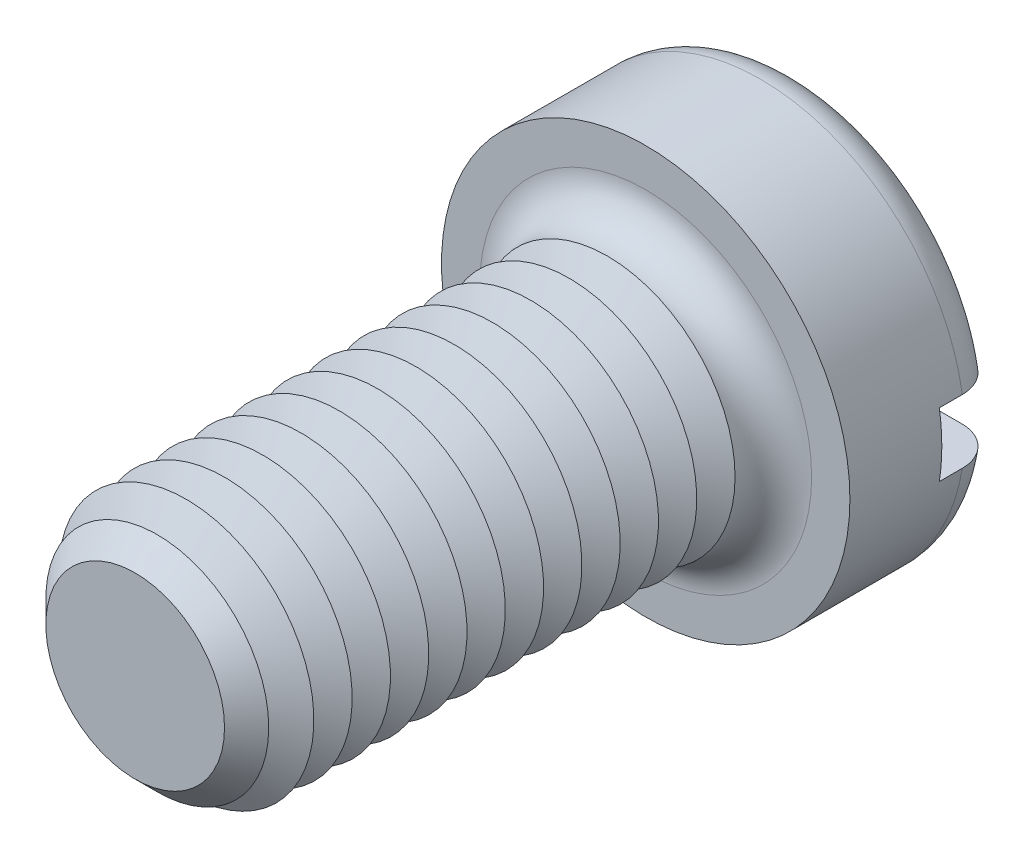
SolidWorks part; units mm, degrees
ref_plane "Front Plane" through (0, 0, 0) normal (0, 0, 1) x (1, 0, 0)
ref_plane "Top Plane" through (0, 0, 0) normal (0, 1, 0) x (1, 0, 0)
ref_plane "Right Plane" through (0, 0, 0) normal (1, 0, 0) x (0, 0, -1)
sketch "Sketch3" plane through (0, 0, 0) normal (0, 0, 1) x (1, 0, 0)
  circle A0 centre (0, 0) radius 8
  dimension "D1" = 16
extrude "Boss-Extrude2" add sketch "Sketch3" against normal blind 6
sketch "Sketch4" plane through (0, 0, 0) normal (0, 0, 1) x (1, 0, 0)
  circle A0 centre (0, 0) radius 5
  dimension "D1" = 10
extrude "Boss-Extrude3" add sketch "Sketch4" along normal blind 20
fillet "Fillet1" radius 1.5 2 edges at (8, 0, -6) (5, 0, 0)
chamfer "Chamfer1" distance 1.5 angle 45 1 edges at (5, 0, 20)
sketch "Sketch5" plane through (0, 0, 0) normal (1, 0, 0) x (0, 0, -1)
  line L0 (1.6944, 0) -> (-7.6738, 0) construction
sketch "Sketch6" plane through (0, 0, 0) normal (1, 0, 0) x (0, 0, -1)
  line L0 (-1.5, 5) -> (-2.25, 3.701)
  line L1 (-2.25, 3.701) -> (-3, 5)
  line L2 (-1.5, 5) -> (-18.5, 5) construction
  line L3 (-3, 5) -> (-1.5, 5)
  dimension "D1" = 1.5
revolve "Cut-Revolve1" cut sketch "Sketch6" angle 360 about L0
pattern_linear "LPattern1" count 12 spacing 1.5 along (0, 0, 1) of "Cut-Revolve1"
sketch "Sketch8" plane through (0, 0, -6) normal (0, 0, -1) x (-1, 0, 0)
  line L1 (8, -1.25) -> (-8, -1.25)
  line L2 (8, -1.25) -> (8, 1.25)
  line L3 (8, 1.25) -> (-8, 1.25)
  line L4 (-8, -1.25) -> (-8, 1.25)
  line L5 (8, -1.25) -> (-8, 1.25) construction
  line L6 (8, 1.25) -> (-8, -1.25) construction
  point P0 (0, 0)
  dimension "D1" = 16
  dimension "D2" = 2.5
extrude "Cut-Extrude1" cut sketch "Sketch8" against normal blind 2.4
